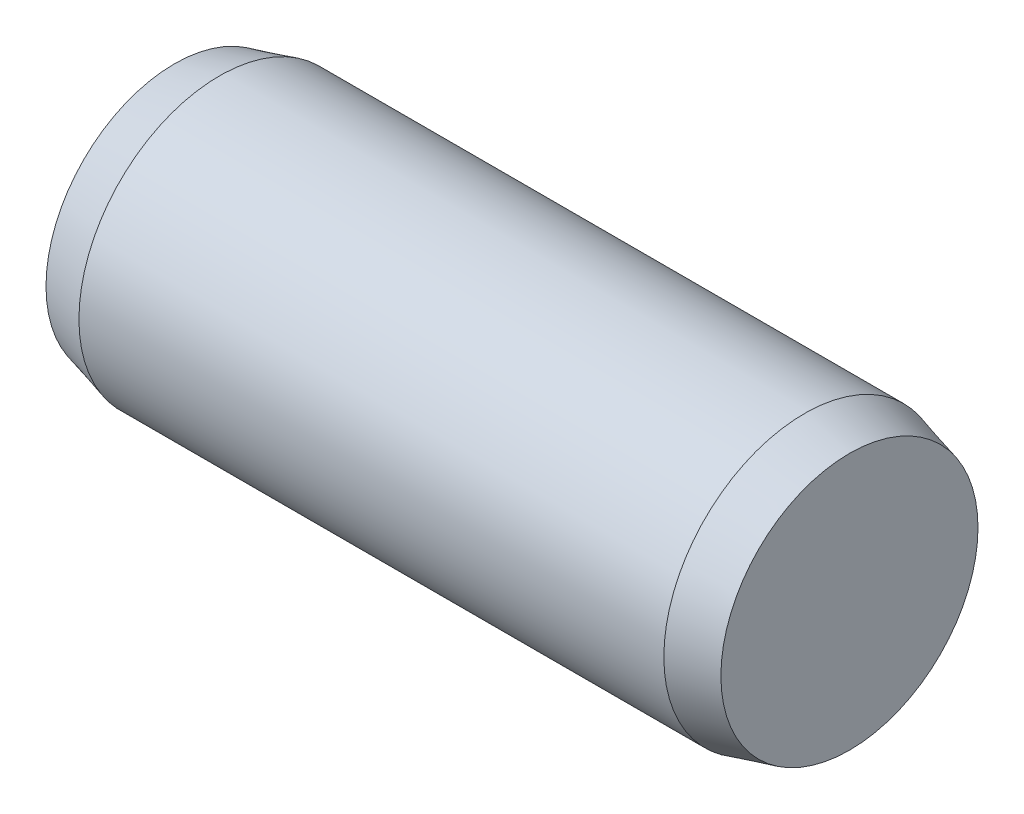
SolidWorks part; units mm, degrees
ref_plane "Plane1" through (0, 0, 0) normal (0, 0, 1) x (1, 0, 0)
ref_plane "Plane2" through (0, 0, 0) normal (0, 1, 0) x (1, 0, 0)
ref_plane "Plane3" through (0, 0, 0) normal (1, 0, 0) x (0, 0, -1)
sketch "Sketch1" plane through (0, 0, 0) normal (0, 0, 1) x (1, 0, 0)
  line L1 (-6.35, 0) -> (107.95, 0) construction
  line L2 (0, 0) -> (12, 0)
  line L3 (12, 0) -> (12, 2.2856)
  line L4 (12, 2.2856) -> (11.2, 2.5)
  line L5 (11.2, 2.5) -> (0.8, 2.5)
  line L6 (0, 2.2856) -> (0, 0)
  line L7 (0, 2.2856) -> (0.8, 2.5)
  dimension "D1" = 0.8
  dimension "D2" = 15
  dimension "D3" = 15
  dimension "Diameter" = 5
  dimension "Length" = 12
  dimension "Chamfer_len" = 0.8
revolve "Base-Revolve" add sketch "Sketch1" angle 360 about L1
equation "\"D3@Sketch1\" = 15.0"
equation "\"D1@Sketch1\" = \"Chamfer_len@Sketch1\""
equation "\"D2@Sketch1\" = \"D3@Sketch1\""
